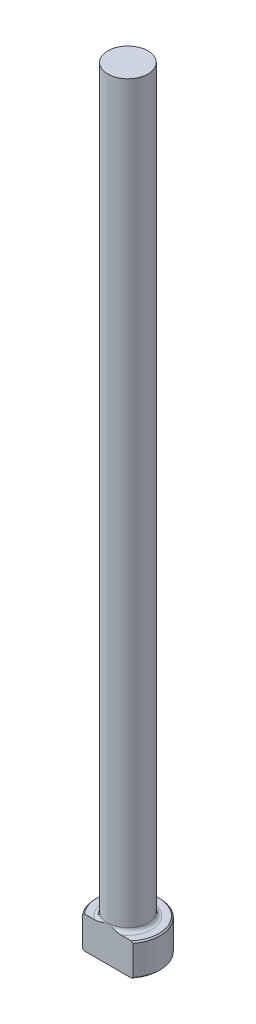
SolidWorks part; units mm, degrees
ref_plane "Front Plane" through (0, 0, 0) normal (0, 0, 1) x (1, 0, 0)
ref_plane "Top Plane" through (0, 0, 0) normal (0, 1, 0) x (1, 0, 0)
ref_plane "Right Plane" through (0, 0, 0) normal (1, 0, 0) x (0, 0, -1)
sketch "Sketch1" plane through (0, 0, 0) normal (0, 0, 1) x (1, 0, 0)
  line L0 (0, 259.9588) -> (0, -15.1925) construction
  line L1 (0, 0) -> (-6.35, 0)
  line L2 (-6.35, 0) -> (-6.35, 6.35)
  line L3 (-6.35, 6.35) -> (-3.9687, 6.35)
  line L4 (-3.9687, 6.35) -> (-3.9687, 152.4)
  line L5 (-3.9687, 152.4) -> (0, 152.4)
  line L6 (0, 152.4) -> (0, 0)
  dimension "L" = 152.4
  dimension "H" = 12.7
  dimension "T" = 6.35
  dimension "D" = 7.9375
revolve "Revolve1" add sketch "Sketch1" angle 360 about L0
chamfer "Chamfer1" distance 0.254 angle 45 2 edges at (0, 6.35, 6.35) (0, 0, 6.35)
fillet "Fillet1" radius 0.762 1 edges at (0, 6.35, 3.9687)
sketch "Sketch2" plane through (0, 0, 0) normal (0, 1, 0) x (1, 0, 0)
  line L0 (-4.957, -3.9687) -> (4.957, -3.9687)
  circle A0 centre (0, 0) radius 6.35 construction
  arc A1 (-4.957, -3.9687) -> (4.957, -3.9687) centre (0, 0) ccw
  circle A3 centre (0, 0) radius 3.9687 construction
  dimension "D1" = 0
extrude "Key" cut sketch "Sketch2" along normal through all
sketch "Pocket Sketch" plane through (0, 0, 0) normal (0, 0, 1) x (1, 0, 0)
  line L0 (-6.7469, 0) -> (-6.7469, 6.3754)
  line L1 (-6.7469, 6.3754) -> (-5.1276, 6.3754)
  line L2 (-4.3656, 7.1374) -> (-4.3656, 22.225)
  line L3 (-4.3656, 22.225) -> (0, 22.225)
  line L4 (0, 22.225) -> (0, 0)
  line L5 (0, 0) -> (-6.7469, 0)
  line L6 (0, 12.6104) -> (0, -2.4989) construction
  line L7 (-6.35, 6.096) -> (-6.35, 0.254) construction
  line L8 (6.096, 6.35) -> (-6.096, 6.35) construction
  line L9 (-3.9687, 152.4) -> (-3.9687, 7.112) construction
  line L10 (-5.1276, 6.3754) -> (-4.3656, 7.1374)
  point P3 (-4.3656, 6.3754)
  dimension "D1" = 13.4937
  dimension "D2" = 0.3969
  dimension "D3" = 0.0254
  dimension "D4" = 0.3969
  dimension "D5" = 8.7312
  dimension "D6" = 22.225
